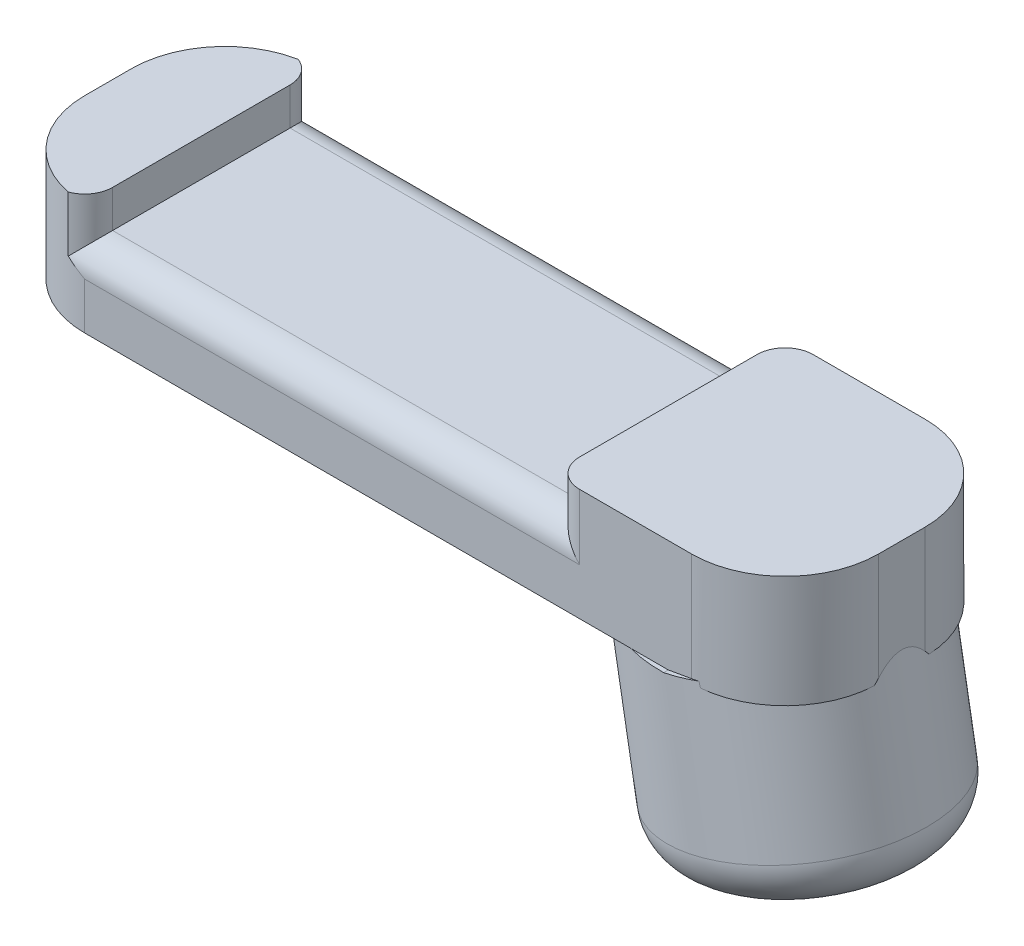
SolidWorks part; units mm, degrees
ref_plane "Plan de face" through (0, 0, 0) normal (0, 0, 1) x (1, 0, 0)
ref_plane "Plan de dessus" through (0, 0, 0) normal (0, 1, 0) x (1, 0, 0)
ref_plane "Plan de droite" through (0, 0, 0) normal (1, 0, 0) x (0, 0, -1)
sketch "Esquisse1" plane through (0, 0, 0) normal (1, 0, 0) x (0, 0, -1)
  line L0 (0, 0) -> (38.7907, 0) construction
  line L1 (12.5, 6) -> (-12.5, 6)
  line L2 (-12.5, 6) -> (-12.5, -6)
  line L3 (-12.5, -6) -> (12.5, -6)
  line L4 (12.5, -6) -> (12.5, 6)
  line L5 (0, 0) -> (0, -10.3008) construction
  dimension "D1" = 12
  dimension "D2" = 25
extrude "Boss.-Extru.1" add sketch "Esquisse1" against normal blind 85
sketch "Esquisse2" plane through (0, 6, 0) normal (0, 1, 0) x (1, 0, 0)
  line L0 (-75, 12.5) -> (-75, -12.5)
  line L1 (-85, 12.5) -> (0, 12.5) construction
  line L2 (-85, -12.5) -> (0, -12.5) construction
  line L3 (-75, -12.5) -> (-25, -12.5)
  line L4 (-25, -12.5) -> (-25, 12.5)
  line L5 (-25, 12.5) -> (-75, 12.5)
  line L6 (-85, 12.5) -> (-85, -12.5) construction
  dimension "D1" = 10
  dimension "D2" = 50
extrude "Enlèv. mat.-Extru.1" cut sketch "Esquisse2" against normal blind 4
sketch "Esquisse3" plane through (0, -6, 0) normal (0, -1, 0) x (1, 0, 0)
  line L0 (-12.5, -12.5) -> (-12.5, 12.5) construction
  line L1 (-85, -12.5) -> (0, -12.5) construction
  line L2 (-85, 12.5) -> (0, 12.5) construction
  line L3 (0, 12.5) -> (0, -12.5) construction
  dimension "D1" = 12.5
ref_plane "Plan1" through (0.6491, -3.6815, 0) normal (-0.1736, 0.9848, 0) x (0, 0, 1)
fillet "Congé17" radius 3 2 edges at (-50, 2, -12.5) (-50, 2, 12.5)
fillet "Congé18" radius 3 1 edges at (-75, 2.5, 12.5)
fillet "Congé19" radius 3 1 edges at (-75, 2.5, -12.5)
fillet "Congé23" radius 10 1 edges at (-85, 0, 12.5)
fillet "Congé24" radius 10 1 edges at (-85, 0, -12.5)
fillet "Congé25" radius 3 2 edges at (-25, 2.5, 12.5) (-25, 2.5, -12.5)
fillet "Congé26" radius 10 2 edges at (0, 0, -12.5) (0, 0, 12.5)
sketch "Esquisse4" plane through (0.6491, -3.6815, 0) normal (-0.1736, 0.9848, 0) x (0, 0, 1)
  line L0 (0, 0) -> (0, -29.2991) construction
  circle A0 centre (0, -13.7158) radius 8
  circle A1 centre (0, -13.7158) radius 13
  circle A2 centre (0, -13.7158) radius 10.5
  dimension "D1" = 16
  dimension "D2" = 26
  dimension "D3" = 21
extrude "Boss.-Extru.2" add sketch "Esquisse4" against normal blind 20 and the other way up to surface contours A1 | A2 | A0
fillet "Congé27" radius 5 1 edges at (-22.1878, -28.0168, 0)
